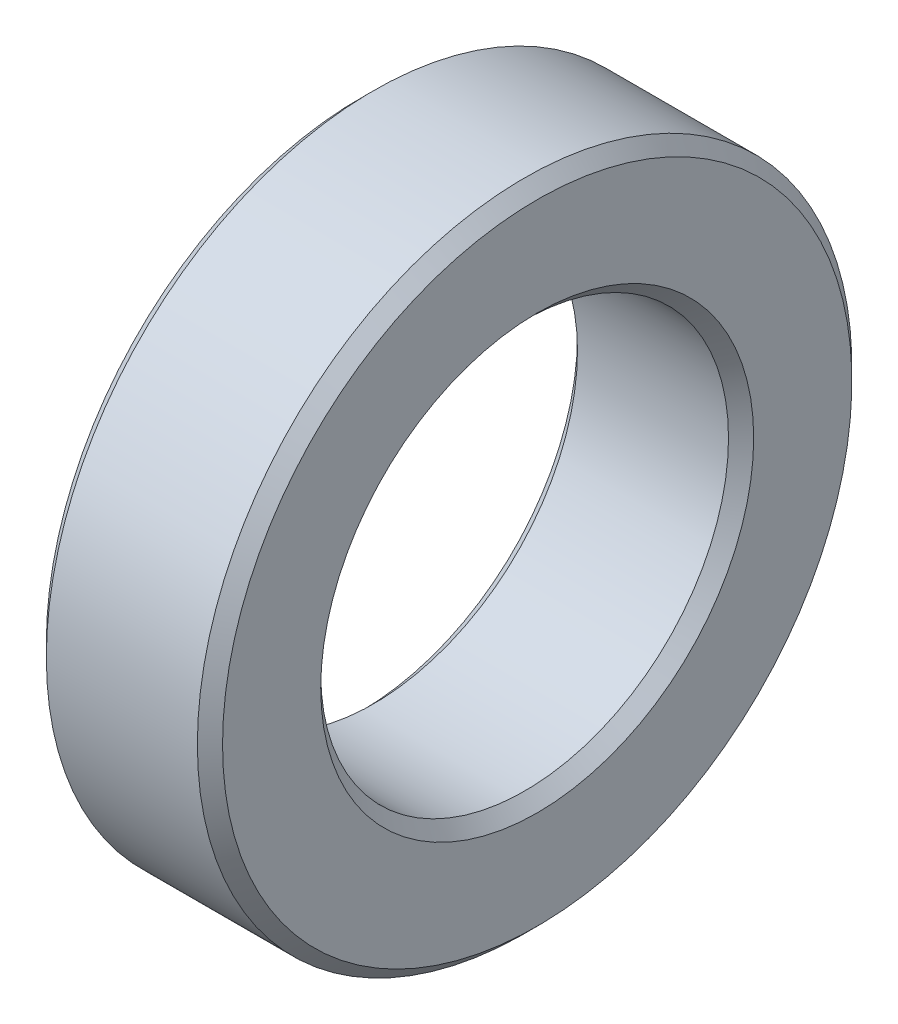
SolidWorks part; units mm, degrees
ref_plane "前视基准面" through (0, 0, 0) normal (0, 0, 1) x (1, 0, 0)
ref_plane "上视基准面" through (0, 0, 0) normal (0, 1, 0) x (1, 0, 0)
ref_plane "右视基准面" through (0, 0, 0) normal (1, 0, 0) x (0, 0, -1)
other "Configuration Table"
sketch "草图1" plane through (0, 0, 0) normal (0, 0, 1) x (1, 0, 0)
  line L0 (0, 0) -> (16.0868, 0) construction
  line L1 (0, 0) -> (7, 0)
  line L6 (0, 0) -> (0, 13)
  line L7 (0, 13) -> (7, 13)
  line L12 (7, 0) -> (7, 13)
  line L13 (0, 0) -> (7, 0)
  line L14 (0, 0) -> (0, 8.1)
  line L15 (0, 8.1) -> (7, 8.1)
  line L16 (7, 0) -> (7, 8.1)
  dimension "D1" = 13
  dimension "D2" = 8.1
  dimension "D3" = 7
revolve "旋转1" add sketch "草图1" angle 360 about L1
chamfer "倒角1" distance 0.5 4 edges at (0, 0, 8.1) (0, 0, 13) (7, 0, 13) (7, 0, 8.1)
